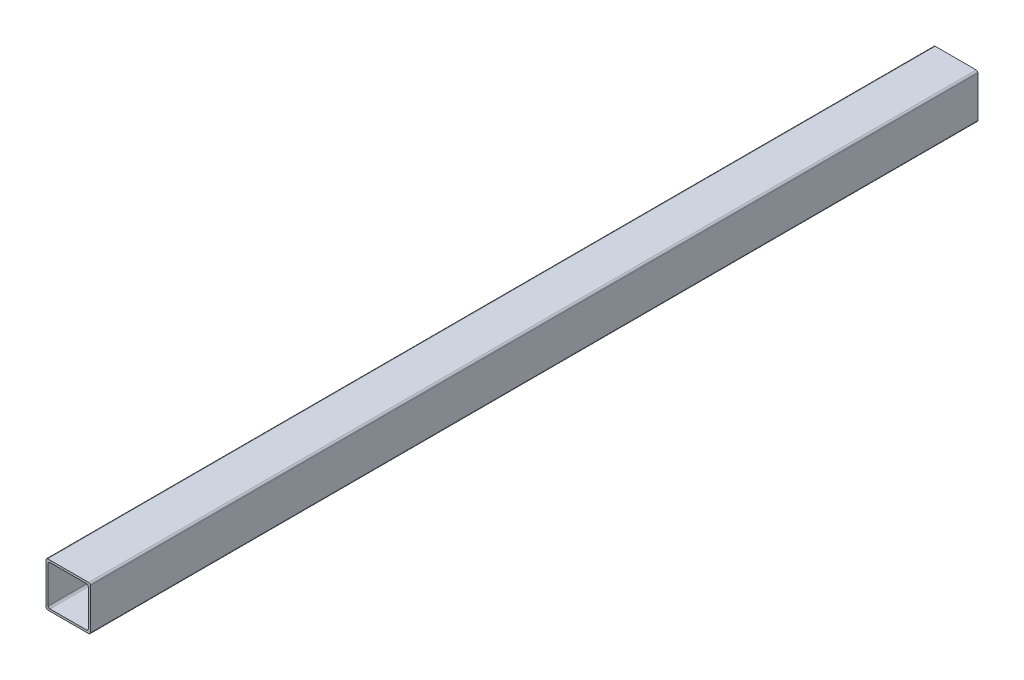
SolidWorks part; units mm, degrees
ref_plane "前视基准面" through (0, 0, 0) normal (0, 0, 1) x (1, 0, 0)
ref_plane "上视基准面" through (0, 0, 0) normal (0, 1, 0) x (1, 0, 0)
ref_plane "右视基准面" through (0, 0, 0) normal (1, 0, 0) x (0, 0, -1)
sketch "草图1" plane through (0, 0, 0) normal (0, 0, 1) x (1, 0, 0)
  line L0 (0, 0) -> (0, 1.2) construction
  line L1 (-11.537, 12.5) -> (11.537, 12.5)
  line L2 (-12.5, 11.537) -> (-12.5, -11.537)
  line L3 (-11.537, -12.5) -> (11.537, -12.5)
  line L4 (12.5, 11.537) -> (12.5, -11.537)
  line L5 (-10.337, 11.3) -> (10.337, 11.3)
  line L6 (-11.3, 10.337) -> (-11.3, -10.337)
  line L7 (-10.337, -11.3) -> (10.337, -11.3)
  line L8 (11.3, 10.337) -> (11.3, -10.337)
  line L9 (-11.3, 0) -> (11.3, 0) construction
  line L10 (0, 11.3) -> (0, 0) construction
  line L11 (0, 0) -> (0, -11.3) construction
  arc A0 (11.537, 12.5) -> (12.5, 11.537) centre (11.537, 11.537) cw
  arc A1 (11.537, -12.5) -> (12.5, -11.537) centre (11.537, -11.537) ccw
  arc A2 (-12.5, -11.537) -> (-11.537, -12.5) centre (-11.537, -11.537) ccw
  arc A3 (-11.537, 12.5) -> (-12.5, 11.537) centre (-11.537, 11.537) ccw
  arc A4 (10.337, -11.3) -> (11.3, -10.337) centre (10.337, -10.337) ccw
  arc A5 (10.337, 11.3) -> (11.3, 10.337) centre (10.337, 10.337) cw
  arc A6 (-10.337, 11.3) -> (-11.3, 10.337) centre (-10.337, 10.337) ccw
  arc A7 (-11.3, -10.337) -> (-10.337, -11.3) centre (-10.337, -10.337) ccw
  point P8 (0, 12.5)
  point P9 (0, 11.3)
  point P10 (11.3, 0)
  point P11 (12.5, 0)
  dimension "r" = 0.963
  dimension "D2" = 25
  dimension "A" = 25
  dimension "D4" = 22.6
  dimension "D5" = 22.6
  dimension "t" = 1.2
extrude "拉伸1" add sketch "草图1" along normal blind 500
sketch "草图2" plane through (0, 0, 0) normal (0, 1, 0) x (1, 0, 0)
  line L0 (0, 0) -> (0, -500)
  dimension "D1" = 500
equation "\"D5@草图1\" = \"A@草图1\"-\"t@草图1\"*2"
equation "\"D4@草图1\" = \"D5@草图1\""
equation "\"D2@草图1\" = \"A@草图1\""
equation "\"D1@草图2\" =\"D1@拉伸1\""
